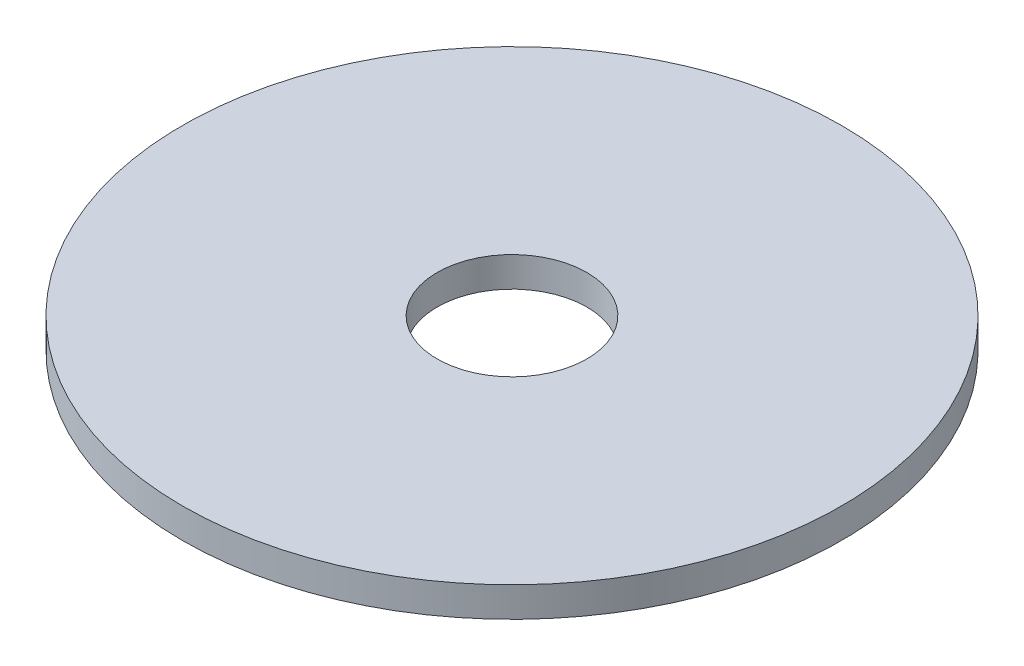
SolidWorks part; units mm, degrees
ref_plane "Piano frontale" through (0, 0, 0) normal (0, 0, 1) x (1, 0, 0)
ref_plane "Piano superiore" through (0, 0, 0) normal (0, 1, 0) x (1, 0, 0)
ref_plane "Piano destro" through (0, 0, 0) normal (1, 0, 0) x (0, 0, -1)
sketch "Schizzo1" plane through (0, 0, 0) normal (0, 0, 1) x (1, 0, 0)
  line L0 (0, 0) -> (0, 49.762) construction
  line L1 (5, 25.381) -> (22, 25.381)
  line L2 (22, 25.381) -> (22, 27.381)
  line L5 (22, 27.381) -> (5, 27.381)
  line L6 (5, 27.381) -> (5, 25.381)
  point P2 (5, 26.381)
  dimension "D2" = 22
  dimension "D3" = 5
  dimension "D5" = 2
revolve "Rivoluzione1" add sketch "Schizzo1" angle 360 about L0
